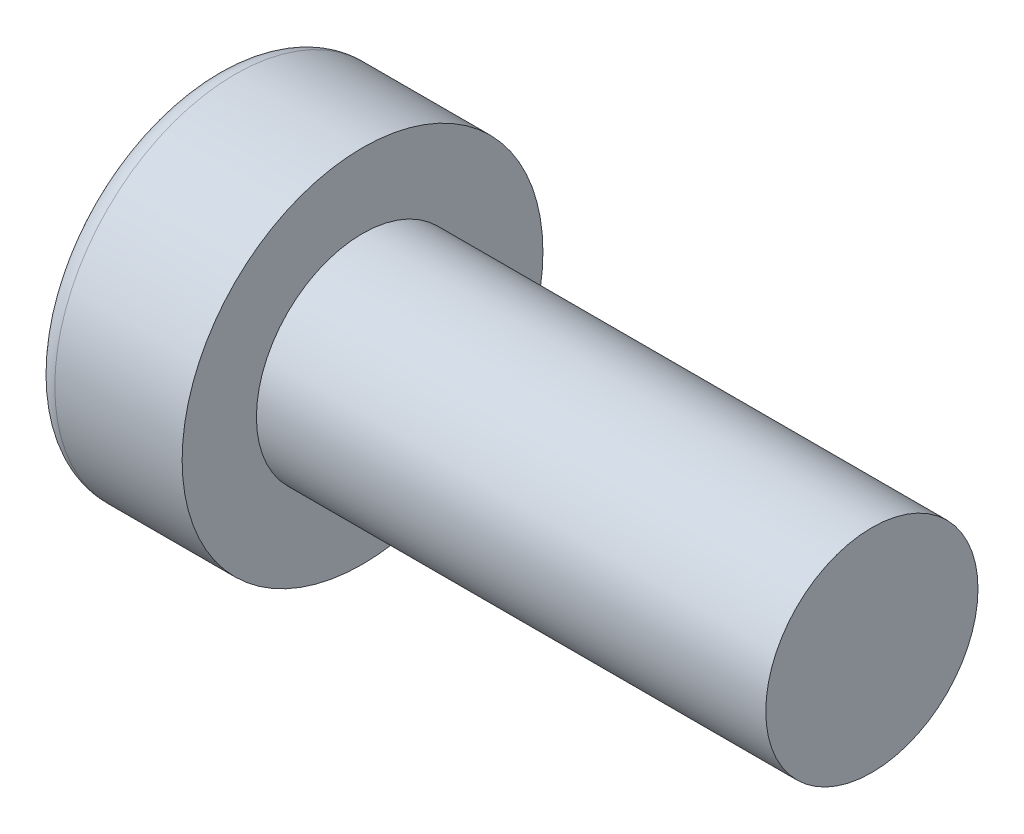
SolidWorks part; units mm, degrees
ref_plane "Ebene vorne" through (0, 0, 0) normal (0, 0, 1) x (1, 0, 0)
ref_plane "Ebene oben" through (0, 0, 0) normal (0, 1, 0) x (1, 0, 0)
ref_plane "Ebene rechts" through (0, 0, 0) normal (1, 0, 0) x (0, 0, -1)
sketch "Skizze1" plane through (0, 0, 0) normal (0, 0, 1) x (1, 0, 0)
  line L0 (-65.0118, 0) -> (64.6036, 0) construction
  line L1 (-15.5, 0) -> (-15.5, 4.25)
  line L2 (-15.5, 4.25) -> (-12, 4.25)
  line L3 (-12, 4.25) -> (-12, 2.5)
  line L4 (-12, 2.5) -> (0, 2.5)
  line L5 (0, 2.5) -> (0, 0)
  line L6 (0, 0) -> (-15.5, 0)
  dimension "D1" = 5
  dimension "D2" = 12
  dimension "D3" = 8.5
  dimension "D4" = 3.5
revolve "Rotation1" add sketch "Skizze1" angle 360 about L0
fillet "Verrundung1" radius 0.5 1 edges at (-15.5, 0, 4.25)
sketch "Skizze2" plane through (-15.5, 0, 0) normal (-1, 0, 0) x (0, 0, 1)
  line L1 (1.5, 0.866) -> (0, 1.7321)
  line L2 (0, 1.7321) -> (-1.5, 0.866)
  line L3 (-1.5, 0.866) -> (-1.5, -0.866)
  line L4 (-1.5, -0.866) -> (0, -1.7321)
  line L5 (0, -1.7321) -> (1.5, -0.866)
  line L6 (1.5, -0.866) -> (1.5, 0.866)
  circle A0 centre (0, 0) radius 1.5 construction
  dimension "D1" = 3
extrude "Schnitt-Linear austragen1" cut sketch "Skizze2" against normal blind 3
